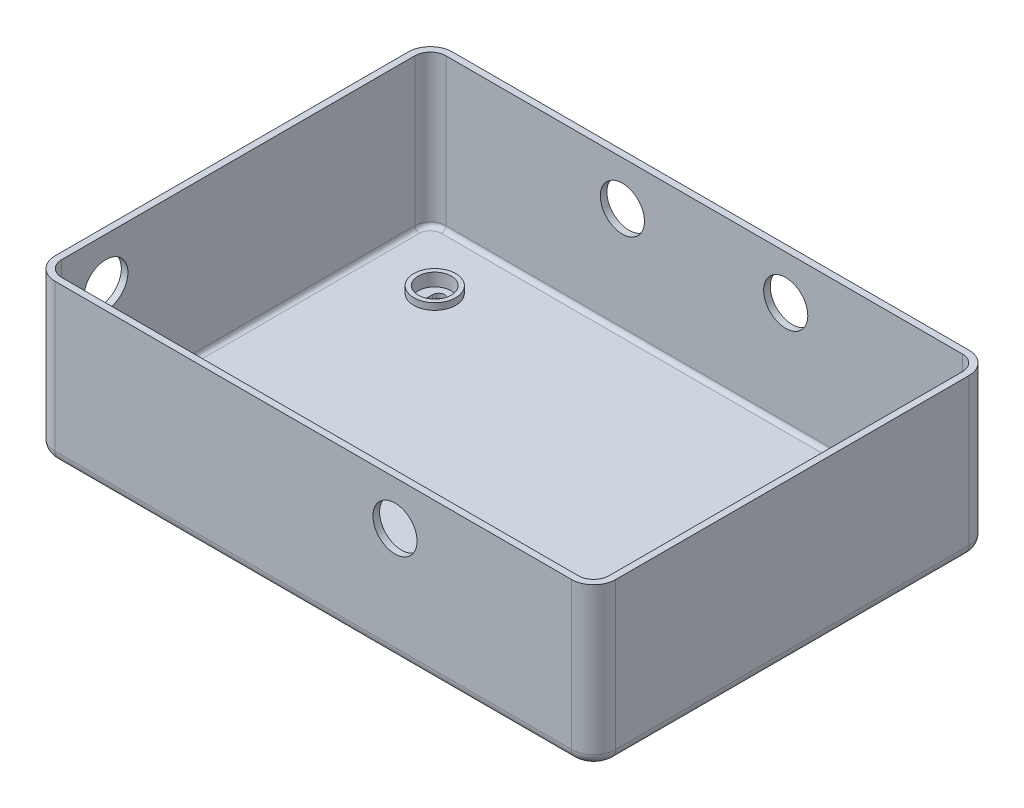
SolidWorks part; units mm, degrees
ref_plane "Ebene vorne" through (0, 0, 0) normal (0, 0, 1) x (1, 0, 0)
ref_plane "Ebene oben" through (0, 0, 0) normal (0, 1, 0) x (1, 0, 0)
ref_plane "Ebene rechts" through (0, 0, 0) normal (1, 0, 0) x (0, 0, -1)
sketch "Skizze2" plane through (0, 0, 0) normal (0, 1, 0) x (1, 0, 0)
  line L1 (127, -90) -> (-127, -90)
  line L2 (127, -90) -> (127, 90)
  line L3 (127, 90) -> (-127, 90)
  line L4 (-127, -90) -> (-127, 90)
  line L5 (127, -90) -> (-127, 90) construction
  line L6 (127, 90) -> (-127, -90) construction
  point P0 (0, 0)
  dimension "D1" = 254
  dimension "D2" = 180
extrude "Aufsatz-Linear austragen1" add sketch "Skizze2" along normal blind 71.7
fillet "Verrundung1" radius 10 4 edges at (-127, 35.85, -90) (127, 35.85, -90) (127, 35.85, 90) (-127, 35.85, 90)
fillet "Verrundung2" radius 5 8 edges at (-124.0711, 0, 87.0711) (-127, 0, 0) (-124.0711, 0, -87.0711) (0, 0, -90) (124.0711, 0, -87.0711) (127, 0, 0) (124.0711, 0, 87.0711) (0, 0, 90)
shell "Wandung1" thickness 3
sketch "Skizze3" plane through (-127, 0, 0) normal (-1, 0, 0) x (0, 0, 1)
  line L0 (90, 71.7) -> (90, 5) construction
  line L1 (-80, 71.7) -> (80, 71.7) construction
  line L2 (0, 0) -> (0, 71.7) construction
  line L3 (80, 0) -> (-80, 0) construction
  line L4 (60, 51.7) -> (0, 51.7) construction
  circle A0 centre (60, 51.7) radius 10
  dimension "D1" = 20
  dimension "D2" = 30
  dimension "D3" = 20
extrude "Schnitt-Linear austragen1" cut sketch "Skizze3" against normal up to next
sketch "Skizze4" plane through (0, 0, -90) normal (0, 0, -1) x (-1, 0, 0)
  line L1 (-117, 71.7) -> (117, 71.7) construction
  line L5 (127, 71.7) -> (127, 5) construction
  line L6 (-127, 5) -> (-127, 71.7) construction
  circle A0 centre (37, 51.7) radius 10
  circle A2 centre (-37, 51.7) radius 10
  dimension "D1" = 20
  dimension "D5" = 20
  dimension "D2" = 20
  dimension "D3" = 90
  dimension "D4" = 90
  dimension "D6" = 20
extrude "Schnitt-Linear austragen2" cut sketch "Skizze4" against normal up to next
sketch "Skizze5" plane through (0, 0, 90) normal (0, 0, 1) x (1, 0, 0)
  line L0 (-117, 71.7) -> (117, 71.7) construction
  line L2 (127, 71.7) -> (127, 5) construction
  circle A0 centre (37, 51.7) radius 10
  point P6 (125.3459, 54.9962)
  dimension "D1" = 20
  dimension "D2" = 20
  dimension "D3" = 90
extrude "Schnitt-Linear austragen3" cut sketch "Skizze5" along direction (0, 0, -1) on the side against the normal up to next (3 mm away)
sketch "Skizze6" plane through (0, 0, 0) normal (0, -1, 0) x (1, 0, 0)
  line L0 (0, 0) -> (-109.8555, 0) construction
  line L1 (0, 0) -> (0, 76.8467) construction
  circle A0 centre (-95, 60) radius 9.5
  circle A1 centre (95, 60) radius 9.5
  circle A2 centre (95, -60) radius 9.5
  circle A3 centre (-95, -60) radius 9.5
  dimension "D3" = 19
  dimension "D1" = 60
  dimension "D2" = 95
extrude "Aufsatz-Linear austragen2" add sketch "Skizze6" against normal blind 6 and the other way blind 1.8
sketch "Skizze10" plane through (0, 6, 0) normal (0, 1, 0) x (1, 0, 0)
  circle A2 centre (95, -60) radius 7.5
  circle A3 centre (95, -60) radius 7.5
  dimension "D1" = 2
extrude "Schnitt-Linear austragen6" cut sketch "Skizze10" against normal offset from surface (5.8 mm away) 2
pattern_linear "Lineares Muster1" count 2 spacing 120 along (0, 0, -1) count 2 spacing 190 along (-1, 0, 0) of "Schnitt-Linear austragen6"
sketch "Skizze7" plane through (0, -1.8, 0) normal (0, -1, 0) x (1, 0, 0)
  line L0 (-95, 58.25) -> (-95, 61.75) construction
  line L1 (-97.75, 58.25) -> (-97.75, 61.75)
  line L2 (-92.25, 58.25) -> (-92.25, 61.75)
  line L3 (-95, -61.75) -> (-95, -58.25) construction
  line L4 (-97.75, -61.75) -> (-97.75, -58.25)
  line L5 (-92.25, -61.75) -> (-92.25, -58.25)
  line L6 (93.25, -60) -> (96.75, -60) construction
  line L7 (93.25, -57.25) -> (96.75, -57.25)
  line L8 (93.25, -62.75) -> (96.75, -62.75)
  line L9 (96.75, 60) -> (93.25, 60) construction
  line L10 (96.75, 57.25) -> (93.25, 57.25)
  line L11 (96.75, 62.75) -> (93.25, 62.75)
  arc A0 (-97.75, 58.25) -> (-92.25, 58.25) centre (-95, 58.25) ccw
  arc A1 (-92.25, 61.75) -> (-97.75, 61.75) centre (-95, 61.75) ccw
  arc A2 (-97.75, -61.75) -> (-92.25, -61.75) centre (-95, -61.75) ccw
  arc A3 (-92.25, -58.25) -> (-97.75, -58.25) centre (-95, -58.25) ccw
  arc A4 (93.25, -57.25) -> (93.25, -62.75) centre (93.25, -60) ccw
  arc A5 (96.75, -62.75) -> (96.75, -57.25) centre (96.75, -60) ccw
  arc A6 (96.75, 57.25) -> (96.75, 62.75) centre (96.75, 60) ccw
  arc A7 (93.25, 62.75) -> (93.25, 57.25) centre (93.25, 60) ccw
  point P2 (-95, 60)
  point P10 (-95, -60)
  point P18 (95, -60)
  point P26 (95, 60)
extrude "Schnitt-Linear austragen4" cut sketch "Skizze7" against normal up to next
